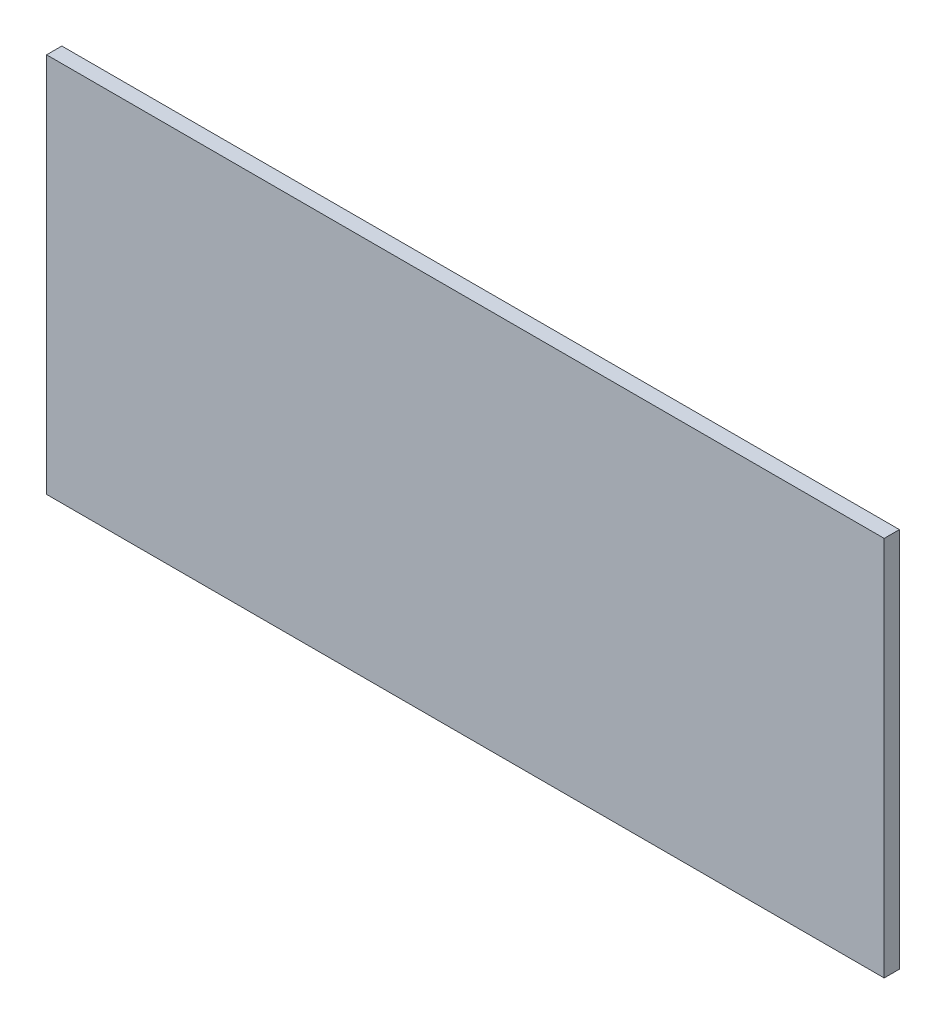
SolidWorks part; units mm, degrees
ref_plane "Plan de face" through (0, 0, 0) normal (0, 0, 1) x (1, 0, 0)
ref_plane "Plan de dessus" through (0, 0, 0) normal (0, 1, 0) x (1, 0, 0)
ref_plane "Plan de droite" through (0, 0, 0) normal (1, 0, 0) x (0, 0, -1)
sketch "Esquisse1" plane through (0, 0, 0) normal (0, 0, 1) x (1, 0, 0)
  line L1 (-5500, 2500) -> (5500, 2500)
  line L2 (-5500, 2500) -> (-5500, -2500)
  line L3 (-5500, -2500) -> (5500, -2500)
  line L4 (5500, 2500) -> (5500, -2500)
  dimension "D1" = 5000
  dimension "D2" = 11000
  dimension "D3" = 5500
  dimension "D4" = 2500
extrude "Boss.-Extru.1" add sketch "Esquisse1" along normal blind 200
